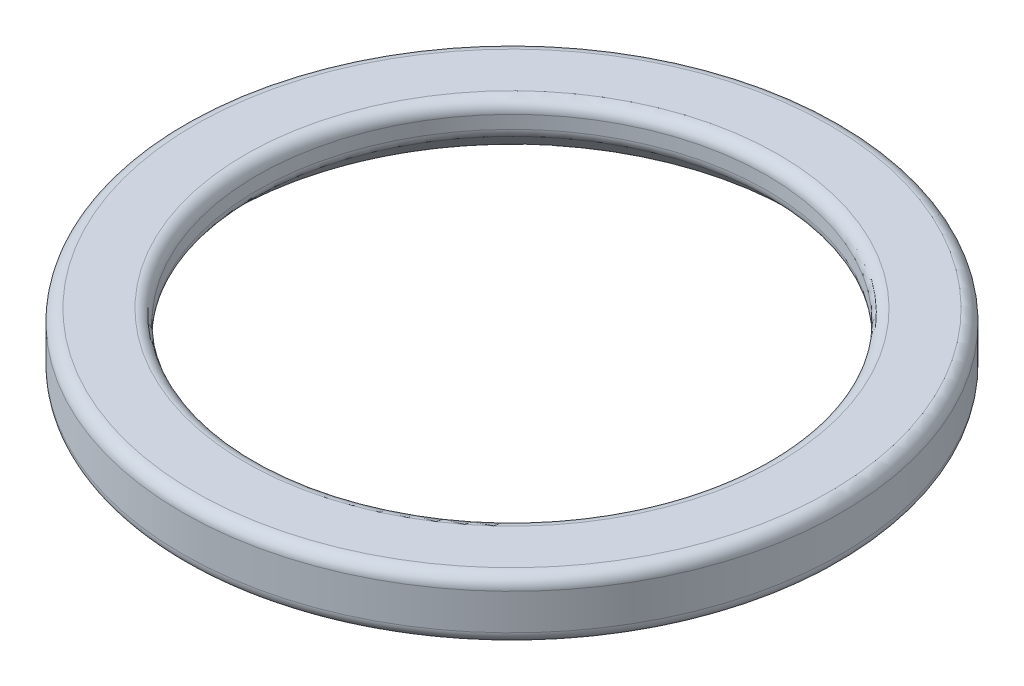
SolidWorks part; units mm, degrees
ref_plane "Face" through (0, 0, 0) normal (0, 0, 1) x (1, 0, 0)
ref_plane "dessus" through (0, 0, 0) normal (0, 1, 0) x (1, 0, 0)
ref_plane "Coté" through (0, 0, 0) normal (1, 0, 0) x (0, 0, -1)
sketch "Esquisse1" plane through (0, 0, 0) normal (0, 0, 1) x (1, 0, 0)
  line L0 (0.0069, 0) -> (17.3053, 0) construction
  line L1 (0.0069, 0) -> (0.0069, 12.6035) construction
  line L2 (9.6726, 0) -> (10.6069, 0)
  line L5 (8.5069, 1.6) -> (8.5069, 1.1657)
  line L6 (8.624, 0.8828) -> (9.3897, 0.1172)
  line L7 (8.9069, 2) -> (10.6069, 2)
  line L8 (11.0069, 1.6) -> (11.0069, 0.4)
  arc A1 (8.5069, 1.6) -> (8.9069, 2) centre (8.9069, 1.6) cw
  arc A2 (11.0069, 1.6) -> (10.6069, 2) centre (10.6069, 1.6) ccw
  arc A3 (10.6069, 0) -> (11.0069, 0.4) centre (10.6069, 0.4) ccw
  arc A4 (8.624, 0.8828) -> (8.5069, 1.1657) centre (8.9069, 1.1657) cw
  arc A5 (9.6726, 0) -> (9.3897, 0.1172) centre (9.6726, 0.4) cw
  dimension "D1" = 2.5
  dimension "D2" = 0.4
  dimension "D6" = 9.6657
  dimension "D7" = 0.4
  dimension "D3" = 8.5
  dimension "D4" = 2
  dimension "D5" = 135
  dimension "D8" = 0.8828
  dimension "D9" = 1.7
  dimension "D10" = 1.2
revolve "Base-Révolution" add sketch "Esquisse1" angle 360 about L1
